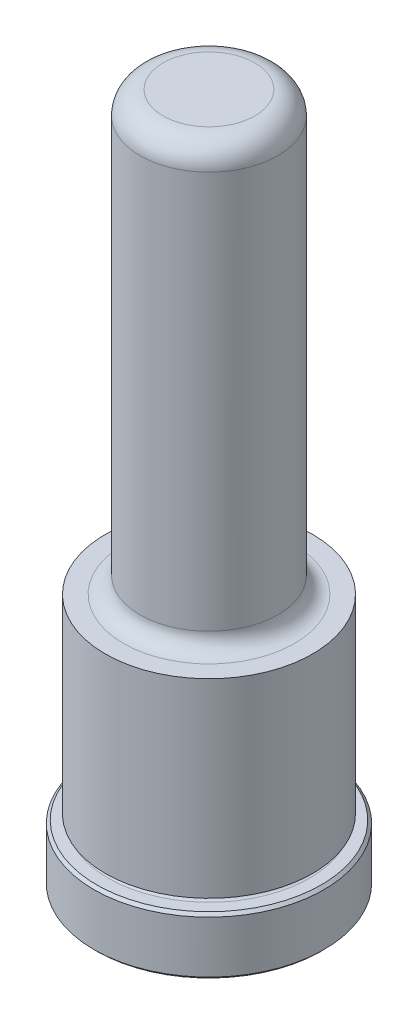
SolidWorks part; units mm, degrees
ref_plane "Front Plane" through (0, 0, 0) normal (0, 0, 1) x (1, 0, 0)
ref_plane "Top Plane" through (0, 0, 0) normal (0, 1, 0) x (1, 0, 0)
ref_plane "Right Plane" through (0, 0, 0) normal (1, 0, 0) x (0, 0, -1)
sketch "Sketch1" plane through (0, 0, 0) normal (1, 0, 0) x (0, 0, -1)
  line L0 (0, 0) -> (15.875, 0)
  line L1 (15.875, 0) -> (15.875, 7.9248)
  line L2 (15.875, 7.9248) -> (13.8938, 7.9248)
  line L3 (13.5128, 2.6782) -> (13.5128, 5.9795) construction
  line L4 (13.8938, 8.6868) -> (14.3002, 8.6868)
  line L5 (14.3002, 8.6868) -> (14.3002, 34.925)
  line L6 (14.3002, 34.925) -> (11.7983, 34.925)
  line L7 (9.5123, 37.211) -> (9.5123, 95.25)
  line L9 (9.5123, 95.25) -> (0, 95.25)
  line L10 (0, 95.25) -> (0, 0)
  line L11 (0, 0) -> (0, -7.2694) construction
  arc A0 (13.8938, 8.6868) -> (13.8938, 7.9248) centre (13.8938, 8.3058) ccw
  arc A1 (11.7983, 34.925) -> (9.5123, 37.211) centre (11.7983, 37.211) cw
  point P2 (9.5123, 95.25)
  point P14 (9.5123, 95.4341)
  point P19 (9.5123, 34.925)
  dimension "D14" = 0.762
  dimension "D8" = 2.286
  dimension "T" = 7.9248
  dimension "D2" = 0.762
  dimension "M" = 31.75
  dimension "B" = 28.6004
  dimension "L" = 95.25
  dimension "D7" = 0.7874
  dimension "A" = 34.925
  dimension "D" = 19.0246
  dimension "D15" = 60.325
revolve "Revolve1" add sketch "Sketch1" angle 360 about L11
chamfer "Chamfer1" distance 0.381 angle 45 2 edges at (0, 0, 15.875) (0, 7.9248, 15.875)
fillet "Fillet7" radius 3.175 1 edges at (0, 95.25, 9.5123)
